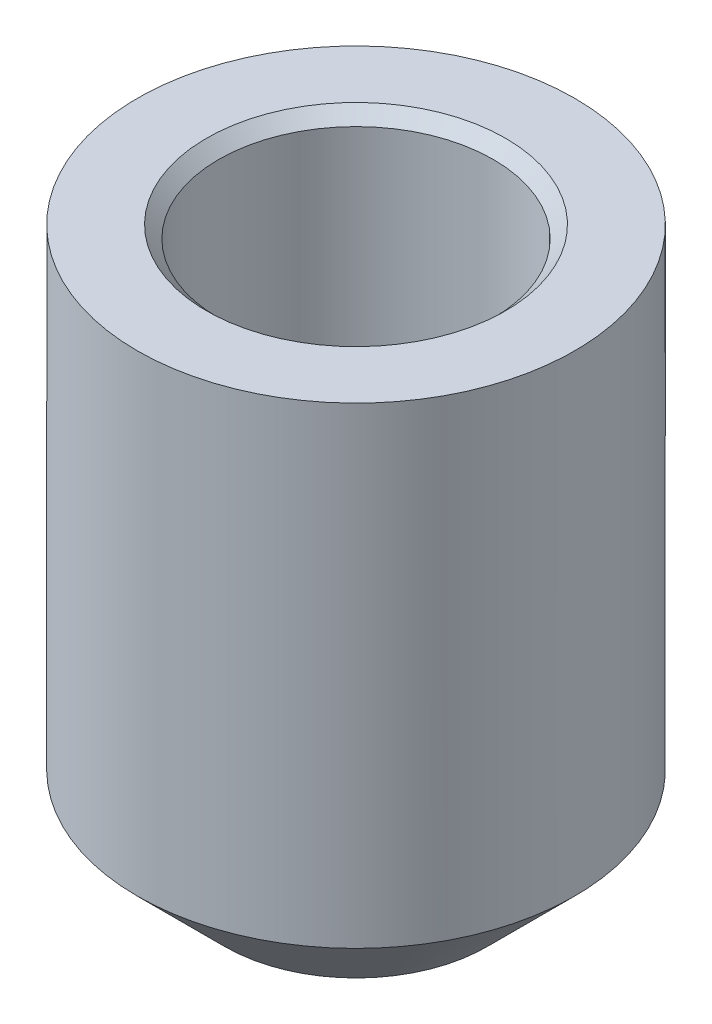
SolidWorks part; units mm, degrees
ref_plane "Front" through (0, 0, 0) normal (0, 0, 1) x (1, 0, 0)
ref_plane "Top" through (0, 0, 0) normal (0, 1, 0) x (1, 0, 0)
ref_plane "Right" through (0, 0, 0) normal (1, 0, 0) x (0, 0, -1)
sketch "Sketch1" plane through (0, 0, 0) normal (0, 0, 1) x (1, 0, 0)
  line L0 (0, 0) -> (0, -46.493) construction
  line L1 (1.9939, 0) -> (1.9939, -3.556)
  line L2 (0, -8.128) -> (3.1763, -8.128)
  line L3 (3.1763, -8.128) -> (3.1763, -1.778)
  line L4 (3.1763, -1.778) -> (4.1402, -1.778)
  line L5 (4.1402, -1.778) -> (4.1402, 0)
  line L6 (4.1402, 0) -> (1.9939, 0)
  line L7 (1.9939, -3.556) -> (0, -3.556)
  line L8 (0, -3.556) -> (0, -8.128)
  dimension "D1" = 6.3525
  dimension "D2" = 8.2804
  dimension "D3" = 3.9878
  dimension "D4" = 6.35
  dimension "D5" = 1.1824
  dimension "D6" = 1.778
  dimension "D7" = 3.556
revolve "Revolve1" add sketch "Sketch1" angle 360 about L0
chamfer "Chamfer1" distance 1.27 angle 45 1 edges at (0, -8.128, 3.1763)
chamfer "Chamfer2" distance 0.1778 angle 45 1 edges at (0, 0, 1.9939)
sketch "Sketch2" plane through (0, -1.778, 0) normal (0, -1, 0) x (1, 0, 0)
  circle A0 centre (0, 0) radius 3.1763
  circle A1 centre (0, 0) radius 3.1763 construction
extrude "Cut-Extrude1" cut sketch "Sketch2" against normal through all flip side to cut
chamfer "Chamfer3" distance 0.1778 angle 45 1 edges at (0, -3.556, 1.9939)
